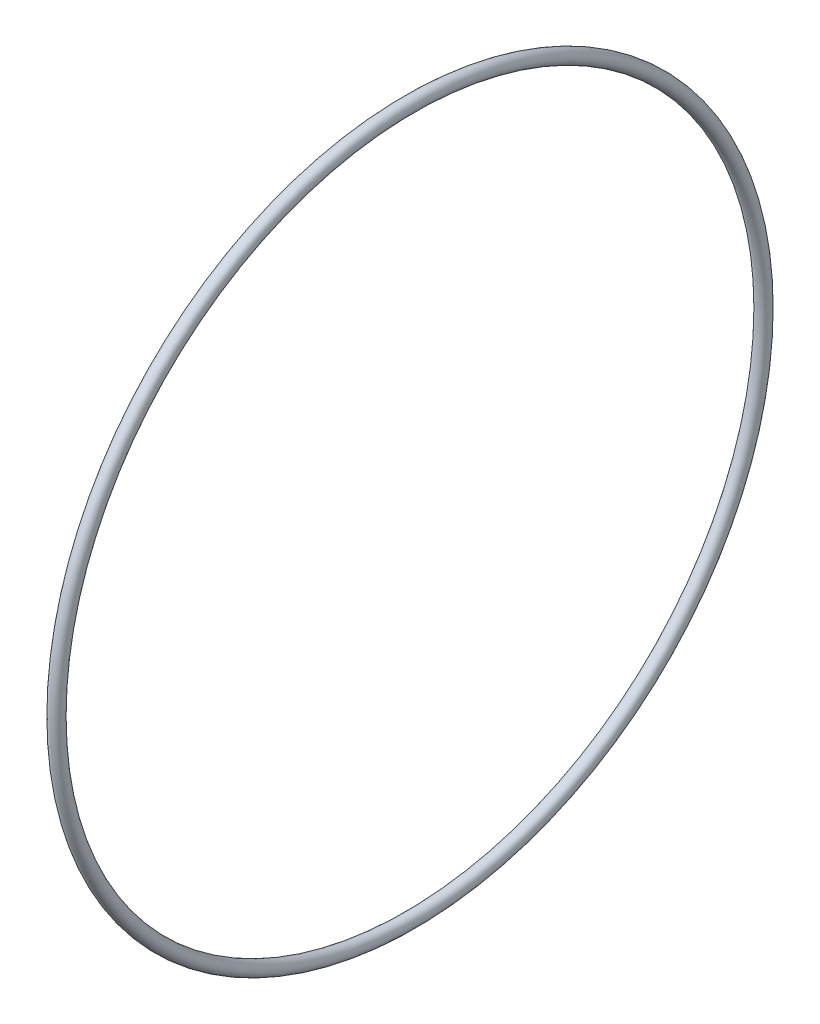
SolidWorks part; units mm, degrees
ref_plane "Front" through (0, 0, 0) normal (0, 0, 1) x (1, 0, 0)
ref_plane "Top" through (0, 0, 0) normal (0, 1, 0) x (1, 0, 0)
ref_plane "Right" through (0, 0, 0) normal (1, 0, 0) x (0, 0, -1)
sketch "Sketch1" plane through (0, 0, 0) normal (0, 0, 1) x (1, 0, 0)
  line L0 (0, 0) -> (-7.4041, 0) construction
  circle A0 centre (0, 91.5924) radius 1.7653
  dimension "D1" = 3.5306
  dimension "D2" = 89.8271
revolve "Revolve1" add sketch "Sketch1" angle 360 about L0
